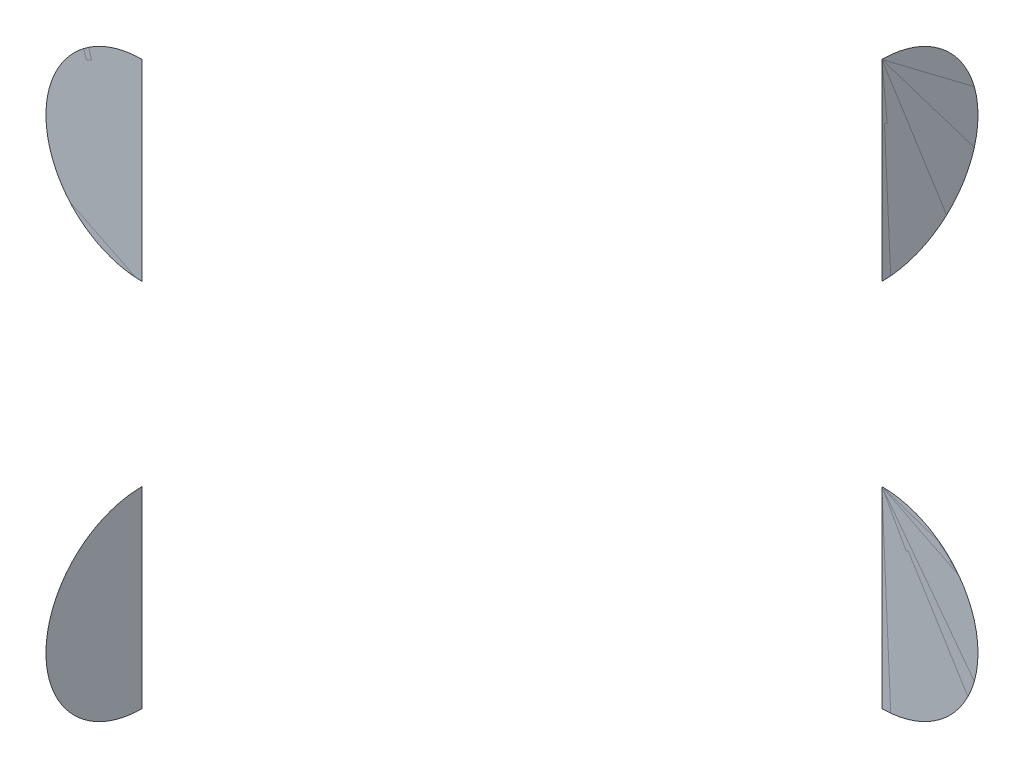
SolidWorks part; units mm, degrees
ref_plane "Front Plane" through (0, 0, 0) normal (0, 0, 1) x (1, 0, 0)
ref_plane "Top Plane" through (0, 0, 0) normal (0, 1, 0) x (1, 0, 0)
ref_plane "Right Plane" through (0, 0, 0) normal (1, 0, 0) x (0, 0, -1)
sketch "Sketch1" plane through (0, 0, 0) normal (0, 0, 1) x (1, 0, 0)
  line L0 (50000, -25000) -> (50000, 25000) construction
  line L1 (50000, 13000) -> (50000, -13000)
  arc A0 (50000, -13000) -> (50000, 13000) centre (50000, 0) ccw
revolve "Revolve1" add sketch "Sketch1" angle 360 about L0
sketch "Sketch2" plane through (0, 0, 0) normal (0, 0, 1) x (1, 0, 0)
  line L0 (-50000, -25000) -> (-50000, 25000) construction
  line L1 (-50000, -13000) -> (-50000, 13000)
  arc A0 (-50000, 13000) -> (-50000, -13000) centre (-50000, 0) ccw
revolve "Revolve2" add sketch "Sketch2" angle 360 about L0
sketch "Sketch3" plane through (0, 0, 0) normal (1, 0, 0) x (0, 0, -1)
  line L0 (50000, -25000) -> (50000, 25000) construction
  line L1 (50000, 13000) -> (50000, -13000)
  arc A0 (50000, -13000) -> (50000, 13000) centre (50000, 0) ccw
revolve "Revolve3" add sketch "Sketch3" angle 360 about L0
sketch "Sketch4" plane through (0, 0, 0) normal (1, 0, 0) x (0, 0, -1)
  line L0 (-50000, -25000) -> (-50000, 25000) construction
  line L1 (-50000, -13000) -> (-50000, 13000)
  arc A0 (-50000, 13000) -> (-50000, -13000) centre (-50000, 0) ccw
revolve "Revolve4" add sketch "Sketch4" angle 360 about L0
sketch "Sketch5" plane through (0, 0, 0) normal (0, 1, 0) x (1, 0, 0)
  circle A0 centre (50000, 0) radius 13800
  circle A1 centre (50000, 0) radius 13800
  circle A2 centre (-50000, 0) radius 13800
  circle A3 centre (-50000, 0) radius 13800
  circle A4 centre (0, 0) radius 13800
  circle A5 centre (0, 0) radius 13800
  circle A6 centre (0, 0) radius 13800
  circle A7 centre (0, 0) radius 13800
